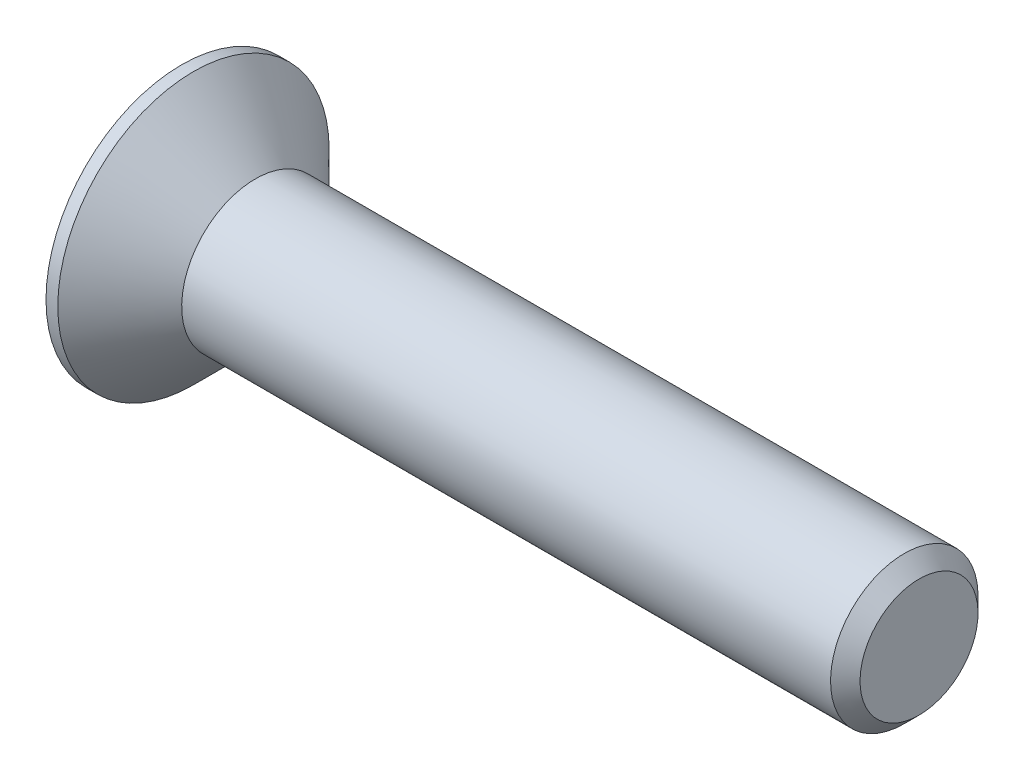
SolidWorks part; units mm, degrees
ref_plane "Front Plane" through (0, 0, 0) normal (0, 0, 1) x (1, 0, 0)
ref_plane "Top Plane" through (0, 0, 0) normal (0, 1, 0) x (1, 0, 0)
ref_plane "Right Plane" through (0, 0, 0) normal (1, 0, 0) x (0, 0, -1)
sketch "Sketch1" plane through (0, 0, 0) normal (0, 0, 1) x (1, 0, 0)
  line L1 (-2.5, 4.6) -> (-2.5, 0)
  line L2 (-2.5, 0) -> (22.5, 0)
  line L3 (22.5, 0) -> (22.5, 2.5)
  line L4 (22.5, 2.5) -> (0, 2.5)
  line L5 (-2.5, 4.6) -> (-2.1, 4.6)
  line L6 (-2.1, 4.6) -> (0, 2.5)
  dimension "D1" = 2.5
  dimension "D2" = 45
  dimension "D3" = 2.5
  dimension "D4" = 25
  dimension "D5" = 4.6
revolve "Revolve1" add sketch "Sketch1" angle 360 about L2
chamfer "Chamfer1" distance 0.5 angle 45 1 edges at (22.5, -2.5, 0)
sketch "Sketch2" plane through (-2.5, 0, 0) normal (-1, 0, 0) x (0, 0, 1)
  line L0 (-0.575, 2.3) -> (0.575, 2.3)
  line L1 (0.575, 2.3) -> (0.575, 0.575)
  line L2 (0.575, 0.575) -> (2.3, 0.575)
  line L3 (2.3, 0.575) -> (2.3, -0.575)
  line L4 (2.3, -0.575) -> (0.575, -0.575)
  line L5 (0.575, -0.575) -> (0.575, -2.3)
  line L6 (0.575, -2.3) -> (-0.575, -2.3)
  line L7 (-0.575, -2.3) -> (-0.575, -0.575)
  line L8 (-0.575, -0.575) -> (-2.3, -0.575)
  line L9 (-2.3, -0.575) -> (-2.3, 0.575)
  line L10 (-2.3, 0.575) -> (-0.575, 0.575)
  line L11 (-0.575, 0.575) -> (-0.575, 2.3)
  point P2 (0, 2.3)
  point P14 (0, -2.3)
  point P15 (2.3, 0)
  point P16 (-2.3, 0)
  dimension "D1" = 4.6
  dimension "D2" = 1.15
extrude "Cut-Extrude1" cut sketch "Sketch2" against normal blind 2.1
